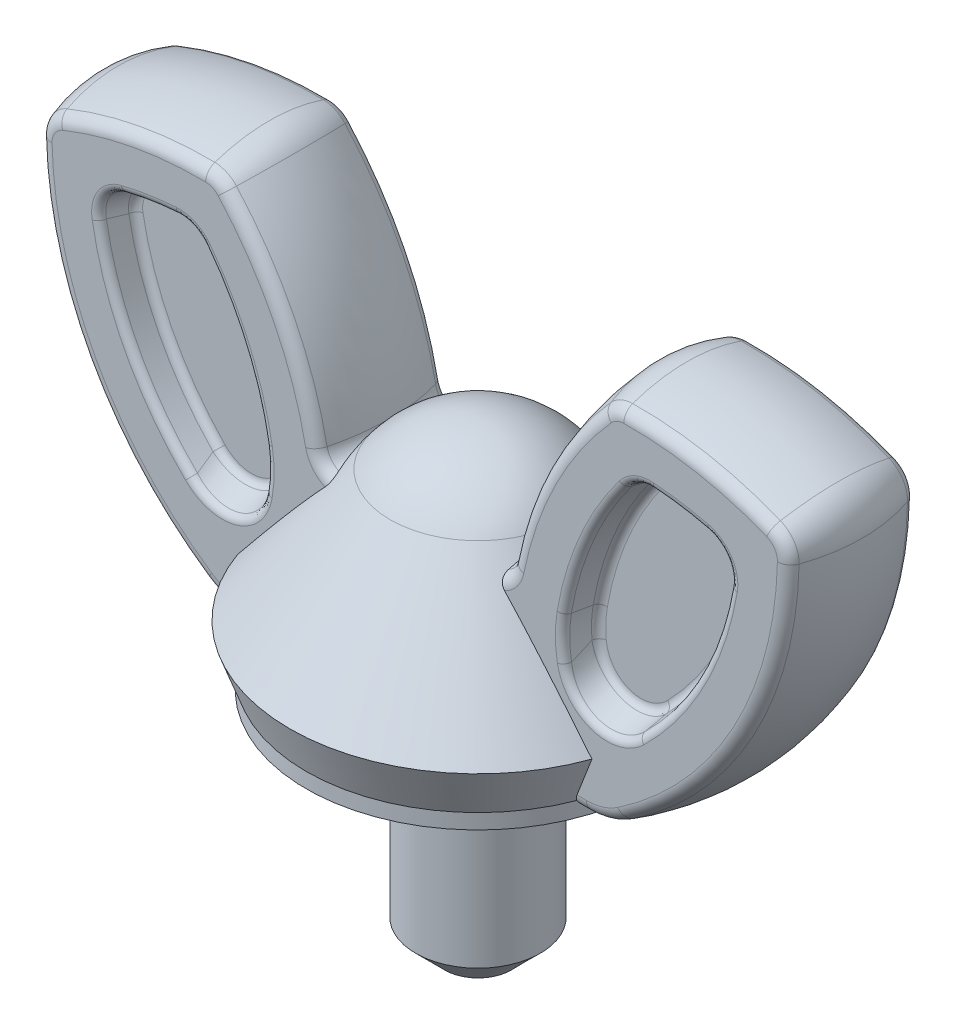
SolidWorks part; units mm, degrees
ref_plane "Front Plane" through (0, 0, 0) normal (0, 0, 1) x (1, 0, 0)
ref_plane "Top Plane" through (0, 0, 0) normal (0, 1, 0) x (1, 0, 0)
ref_plane "Right Plane" through (0, 0, 0) normal (1, 0, 0) x (0, 0, -1)
sketch "Sketch1" plane through (0, 0, 0) normal (0, 0, 1) x (1, 0, 0)
  line L0 (0, 10.7344) -> (0, 0) construction
  line L5 (4.826, 0) -> (-4.826, 0)
  line L6 (2.413, 5.08) -> (-2.413, 5.08)
  arc A11 (-2.413, 5.08) -> (-5.3975, 10.9034) centre (-13.1787, 3.2391) ccw
  arc A13 (-5.3975, 10.9034) -> (-10.795, 9.8298) centre (-6.0342, 0) ccw
  arc A24 (-10.795, 9.8298) -> (-6.0486, 0.3742) centre (0, 9.3295) ccw
  arc A26 (-4.826, 0) -> (-6.0486, 0.3742) centre (-4.826, 2.1844) cw
  arc A29 (4.826, 0) -> (6.0486, 0.3742) centre (4.826, 2.1844) ccw
  arc A34 (10.795, 9.8298) -> (6.0486, 0.3742) centre (0, 9.3295) cw
  arc A36 (5.3975, 10.9034) -> (10.795, 9.8298) centre (6.0342, 0) cw
  arc A37 (2.413, 5.08) -> (5.3975, 10.9034) centre (13.1787, 3.2391) cw
  point P19 (0, 0)
  point P27 (0, 5.08)
  point P29 (0, 5.08)
  point P44 (0, 5.08)
extrude "Extrude1" add sketch "Sketch1" along normal mid plane 3.556
fillet "Fillet4" radius 1.0922 4 edges at (10.795, 9.8298, 0) (5.3975, 10.9034, 0) (-5.3975, 10.9034, 0) (-10.795, 9.8298, 0)
sketch "Sketch2" plane through (0, 0, 1.778) normal (0, 0, 1) x (1, 0, 0)
  line L0 (0, 0) -> (0, 12.8329) construction
  line L1 (-4.826, 0) -> (4.826, 0) construction
  arc A10 (-4.1864, 4.7767) -> (-5.0416, 1.8652) centre (-7.5893, 4.1949) cw
  arc A11 (4.1864, 4.7767) -> (6.2055, 9.1212) centre (13.1787, 3.2391) cw
  arc A12 (6.2055, 9.1212) -> (8.9805, 8.634) centre (6.0342, 0) cw
  arc A13 (8.9805, 8.634) -> (5.0416, 1.8652) centre (0, 9.3295) cw
  arc A14 (4.1864, 4.7767) -> (5.0416, 1.8652) centre (7.5893, 4.1949) ccw
  arc A15 (-8.9805, 8.634) -> (-5.0416, 1.8652) centre (0, 9.3295) ccw
  arc A16 (-6.2055, 9.1212) -> (-8.9805, 8.634) centre (-6.0342, 0) ccw
  arc A17 (-4.1864, 4.7767) -> (-6.2055, 9.1212) centre (-13.1787, 3.2391) ccw
  arc A18 (-8.9805, 8.634) -> (-5.0416, 1.8652) centre (0, 9.3295) ccw
  arc A19 (-6.2055, 9.1212) -> (-8.9805, 8.634) centre (-6.0342, 0) ccw
  arc A20 (-4.1864, 4.7767) -> (-6.2055, 9.1212) centre (-13.1787, 3.2391) ccw
extrude "Cut-Extrude1" cut sketch "Sketch2" against normal blind 0.889 draft 10
fillet "Fillet1" radius 0.889 4 edges
fillet "Fillet6" radius 1.2446 2 edges
fillet "Fillet5" radius 0.3641 2 edges at (2.413, 5.08, 0) (-2.413, 5.08, 0)
fillet "Fillet3" radius 0.2223 28 edges at (7.4585, 9.011, 1.778) (7.4007, 8.8613, 0.889) (6.4621, 8.9114, 0.889) (8.6146, 8.3041, 0.889) (7.8855, 5.3103, 0.889) (4.2988, 4.3764, 0.889) (6.1282, 8.9579, 1.778) (8.7221, 8.5339, 1.778) (7.9776, 5.1471, 1.778) (4.1377, 4.1292, 1.778) (-4.2988, 4.3764, 0.889) (-7.8855, 5.3103, 0.889) (-8.5332, 8.4279, 0.889) (-7.4007, 8.8613, 0.889) (-6.1942, 8.7899, 0.889) (-4.1377, 4.1292, 1.778) (-7.9776, 5.1471, 1.778) (-8.7866, 8.4358, 1.778) (-7.4585, 9.011, 1.778) (-6.3795, 9.0717, 1.778) (4.9351, 6.7652, 0.889) (4.81, 6.8709, 1.778) (-4.9351, 6.7652, 0.889) (-4.81, 6.8709, 1.778) (4.9742, 2.938, 0.889) (5.0791, 2.5366, 1.778) (-5.2102, 2.8514, 0.889) (-5.0131, 2.5568, 1.778)
mirror "Mirror1" about plane through (0, 0, 0) normal (0, 0, 1) of "Fillet6", "Fillet3", "Fillet1", "Cut-Extrude1"
sketch "Sketch4" plane through (0, 0, 0) normal (1, 0, 0) x (0, 0, -1)
  line L1 (-1.778, 5.334) -> (1.778, 5.334)
  line L2 (-1.778, 4.4704) -> (-1.778, 5.334)
  line L4 (1.778, 0.3742) -> (1.778, 9.0918) construction
  line L6 (-1.778, 9.0918) -> (-1.778, 0.3742) construction
  line L7 (0, 5.715) -> (0, 0.381) construction
  line L9 (1.778, 4.4704) -> (1.778, 5.334)
  line L10 (-1.778, 5.08) -> (1.778, 5.08) construction
  arc A0 (-1.524, 4.826) -> (-1.778, 4.4704) centre (-1.4021, 4.4704) ccw
  arc A1 (1.524, 4.826) -> (-1.524, 4.826) centre (0, 0.381) ccw
  arc A2 (1.524, 4.826) -> (1.778, 4.4704) centre (1.4021, 4.4704) cw
  point P8 (0, 5.08)
sketch3d "3DSketch1"
  line L2 (-2.1102, 5.08, 1.778) -> (2.1102, 5.08, 1.778)
  line L3 (4.826, 0, 1.778) -> (-4.826, 0, 1.778)
  line L4 (-2.1102, 5.08, 1.778) -> (2.1102, 5.08, 1.778)
  line L5 (4.826, 0, 1.778) -> (-4.826, 0, 1.778)
  arc A15 (10.804, 9.0918, 1.778) -> (6.0486, 0.3742, 1.778) centre (0, 9.3295, 1.778) ccw
  arc A16 (10.1207, 10.1287, 1.778) -> (10.804, 9.0918, 1.778) centre (9.712, 9.1158, 1.778) ccw
  arc A17 (5.8682, 10.9207, 1.778) -> (10.1207, 10.1287, 1.778) centre (6.0342, 0, 1.778) ccw
  arc A18 (5.0743, 10.5608, 1.778) -> (5.8682, 10.9207, 1.778) centre (5.8848, 9.8287, 1.778) ccw
  arc A19 (2.4672, 5.3729, 1.778) -> (5.0743, 10.5608, 1.778) centre (13.1787, 3.2391, 1.778) ccw
  arc A20 (2.1102, 5.08, 1.778) -> (2.4672, 5.3729, 1.778) centre (2.1102, 5.4441, 1.778) ccw
  arc A21 (2.1102, 5.08, 1.778) -> (2.4672, 5.3729, 1.778) centre (2.1102, 5.4441, 1.778) ccw
  arc A22 (-5.0743, 10.5608, 1.778) -> (-2.4672, 5.3729, 1.778) centre (-13.1787, 3.2391, 1.778) ccw
  arc A23 (-5.8682, 10.9207, 1.778) -> (-5.0743, 10.5608, 1.778) centre (-5.8848, 9.8287, 1.778) ccw
  arc A24 (-10.1207, 10.1287, 1.778) -> (-5.8682, 10.9207, 1.778) centre (-6.0342, 0, 1.778) ccw
  arc A25 (-10.804, 9.0918, 1.778) -> (-10.1207, 10.1287, 1.778) centre (-9.712, 9.1158, 1.778) ccw
  arc A26 (-6.0486, 0.3742, 1.778) -> (-10.804, 9.0918, 1.778) centre (0, 9.3295, 1.778) ccw
  arc A27 (-4.826, 0, 1.778) -> (-6.0486, 0.3742, 1.778) centre (-4.826, 2.1844, 1.778) ccw
  arc A28 (6.0486, 0.3742, 1.778) -> (4.826, 0, 1.778) centre (4.826, 2.1844, 1.778) ccw
  arc A29 (10.804, 9.0918, 1.778) -> (6.0486, 0.3742, 1.778) centre (0, 9.3295, 1.778) ccw
  arc A30 (10.1207, 10.1287, 1.778) -> (10.804, 9.0918, 1.778) centre (9.712, 9.1158, 1.778) ccw
  arc A31 (5.8682, 10.9207, 1.778) -> (10.1207, 10.1287, 1.778) centre (6.0342, 0, 1.778) ccw
  arc A32 (5.0743, 10.5608, 1.778) -> (5.8682, 10.9207, 1.778) centre (5.8848, 9.8287, 1.778) ccw
  arc A33 (2.4672, 5.3729, 1.778) -> (5.0743, 10.5608, 1.778) centre (13.1787, 3.2391, 1.778) ccw
  arc A34 (-2.4672, 5.3729, 1.778) -> (-2.1102, 5.08, 1.778) centre (-2.1102, 5.4441, 1.778) ccw
  arc A35 (-2.4672, 5.3729, 1.778) -> (-2.1102, 5.08, 1.778) centre (-2.1102, 5.4441, 1.778) ccw
  arc A36 (-5.0743, 10.5608, 1.778) -> (-2.4672, 5.3729, 1.778) centre (-13.1787, 3.2391, 1.778) ccw
  arc A37 (-5.8682, 10.9207, 1.778) -> (-5.0743, 10.5608, 1.778) centre (-5.8848, 9.8287, 1.778) ccw
  arc A38 (-10.1207, 10.1287, 1.778) -> (-5.8682, 10.9207, 1.778) centre (-6.0342, 0, 1.778) ccw
  arc A39 (-10.804, 9.0918, 1.778) -> (-10.1207, 10.1287, 1.778) centre (-9.712, 9.1158, 1.778) ccw
  arc A40 (-6.0486, 0.3742, 1.778) -> (-10.804, 9.0918, 1.778) centre (0, 9.3295, 1.778) ccw
  arc A41 (-4.826, 0, 1.778) -> (-6.0486, 0.3742, 1.778) centre (-4.826, 2.1844, 1.778) ccw
  arc A42 (6.0486, 0.3742, 1.778) -> (4.826, 0, 1.778) centre (4.826, 2.1844, 1.778) ccw
  point P3 (2.1102, 5.4441, 2.1421)
  point P5 (2.1102, 5.4441, 2.1421)
  point P11 (-2.1102, 5.4441, 2.1421)
  point P13 (-2.1102, 5.4441, 2.1421)
  point P43 (0, 9.3295, -9.0286)
  point P46 (9.712, 9.1158, 0.6858)
  point P48 (6.0342, 0, -9.144)
  point P50 (5.8848, 9.8287, 0.6858)
  point P52 (13.1787, 3.2391, -9.144)
  point P58 (-13.1787, 3.2391, -9.144)
  point P60 (-5.8848, 9.8287, 0.6858)
  point P62 (-6.0342, 0, -9.144)
  point P64 (-9.712, 9.1158, 0.6858)
  point P66 (0, 9.3295, -9.0286)
  point P68 (-4.826, 2.1844, -0.4064)
  point P70 (4.826, 2.1844, -0.4064)
  point P71 (0, 9.3295, -9.0286)
  point P72 (9.712, 9.1158, 0.6858)
  point P73 (6.0342, 0, -9.144)
  point P74 (5.8848, 9.8287, 0.6858)
  point P75 (13.1787, 3.2391, -9.144)
  point P78 (-13.1787, 3.2391, -9.144)
  point P79 (-5.8848, 9.8287, 0.6858)
  point P80 (-6.0342, 0, -9.144)
  point P81 (-9.712, 9.1158, 0.6858)
  point P82 (0, 9.3295, -9.0286)
  point P83 (-4.826, 2.1844, -0.4064)
  point P84 (4.826, 2.1844, -0.4064)
  dimension "D1" = 0
sweep "Cut-Sweep2" cut profiles "Sketch4" path "3DSketch1"
sketch "Sketch3" plane through (0, 0, 0) normal (0, 0, 1) x (1, 0, 0)
  line L0 (0, 6.5903) -> (0, -11.3525) construction
  line L1 (1.7526, 0) -> (4.826, 0)
  line L2 (5.2882, 1.6933) -> (2.4672, 5.3729)
  line L4 (1.7526, 0) -> (1.7526, -6.35)
  line L5 (1.7526, -6.35) -> (0, -6.35)
  line L6 (4.826, 0) -> (4.826, 0.4233)
  line L7 (0, 6.5903) -> (0, -6.35)
  line L8 (0, 6.5903) -> (-2.4754, 6.5903) construction
  line L9 (4.826, 0.4233) -> (5.2882, 1.6933)
  arc A1 (2.4672, 5.3729) -> (0, 6.5903) centre (0, 3.4814) ccw
revolve "Revolve1" add sketch "Sketch3" angle 360 about L0
sketch "Sketch6" plane through (0, 0, 0) normal (0, 0, 1) x (1, 0, 0)
  line L0 (0, 4.5862) -> (0, -4.5862) construction
  line L3 (0.9398, -6.604) -> (1.778, -6.604)
  line L4 (1.778, -6.604) -> (1.778, -5.5118)
  line L5 (1.778, -5.5118) -> (0.9398, -6.35)
  line L6 (-1.7526, -6.35) -> (1.7526, -6.35) construction
  line L7 (1.7526, -6.35) -> (1.7526, 0) construction
  line L8 (0.9398, -6.35) -> (0.9398, -6.604)
  dimension "D1" = 45
  dimension "D3" = 0.254
  dimension "O" = 1.8796
  dimension "D5" = 0.0254
revolve "Cut-Revolve11" cut sketch "Sketch6" angle 360 about L0
sketch "Sketch5" plane through (0, 0, 0) normal (0, 0, 1) x (1, 0, 0)
  line L0 (1.7526, -0.0254) -> (1.2802, -0.2982)
  line L1 (1.2802, -0.2982) -> (1.7526, -0.5709)
  line L2 (1.7526, -0.5709) -> (1.7526, -0.0254)
  line L3 (0, 0) -> (0, -7.7715) construction
  line L6 (1.2802, -0.2982) -> (1.2802, -1.0906) construction
revolve "Cut-Revolve10" [suppressed] cut sketch "Sketch5" angle 360 about L3
pattern_linear "LPattern10" [suppressed] count 8 spacing 0.7925 along (0, -1, 0)
equation "\"D5@Sketch1\" = \"E@Sketch1\" / 2"
equation "\"D1@Sketch1\" = \"A@Sketch1\" / 4"
equation "\"D3@Sketch1\" = \"B@Sketch1\" * 9 /  10"
equation "\"D4@Sketch1\" = \"B@Sketch1\""
equation "\"D2@Sketch1\" = \"D4@Sketch1\" / 5"
equation "\"D1@Cut-Extrude1\" = \"C@Extrude1\" / 4"
equation "\"D1@Fillet1\" = \"D1@Cut-Extrude1\""
equation "\"D1@Fillet3\" = \"D1@Cut-Extrude1\" / 4"
equation "\"D2@Sketch3\" = \"G@Sketch1\" / 4"
equation "\"D3@Sketch3\" = \"E@Sketch1\""
equation "\"D1@Sketch4\" = \"C@Extrude1\" / 14"
equation "\"D1@Sketch5\" = \"d1@Sketch3\""
equation "\"D2@Sketch5\" = \"THD_MINOR@Cosmetic Thread1\""
equation "\"D3@LPattern10\" = \"pitch@Sketch5\""
equation "\"D1@LPattern10\" = \"L@Sketch3\" / \"D3@LPattern10\""
equation "\"D1@Cosmetic Thread1\" = \"L@Sketch3\""
equation "\"D2@Sketch4\" = \"D1@Sketch4\""
equation "\"D4@Sketch3\" = \"D2@Sketch3\" / 3"
equation "\"D1@Fillet4\" = \"D2@Sketch1\" /2"
equation "\"D1@Sketch2\" = \"D1@Sketch1\" / 3"
equation "\"D1@Fillet5\" = \"D1@Fillet4\" / 3"
equation "\"D1@Fillet6\" = \"D1@Fillet1\" * 1.4"
